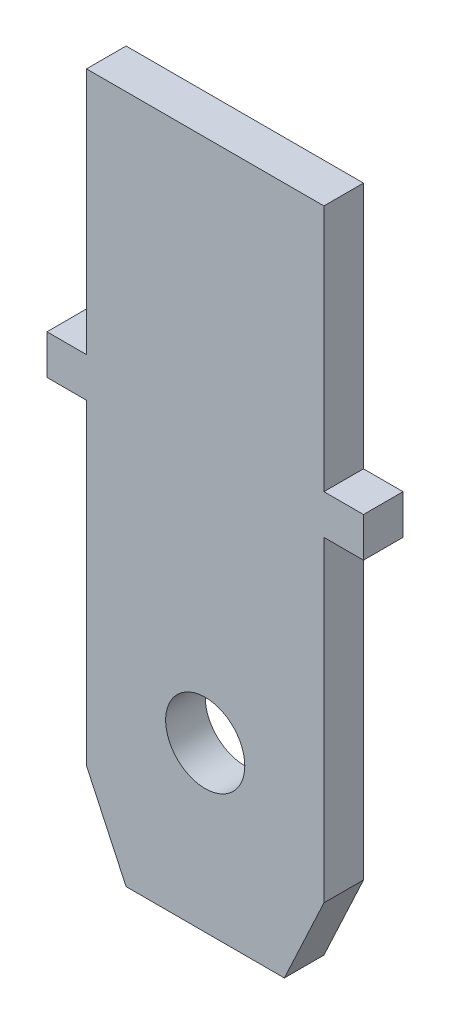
SolidWorks part; units mm, degrees
ref_plane "Plan de face" through (0, 0, 0) normal (0, 0, 1) x (1, 0, 0)
ref_plane "Plan de dessus" through (0, 0, 0) normal (0, 1, 0) x (1, 0, 0)
ref_plane "Plan de droite" through (0, 0, 0) normal (1, 0, 0) x (0, 0, -1)
sketch "Esquisse1" plane through (0, 0, 0) normal (0, 0, 1) x (1, 0, 0)
  line L0 (0, 0) -> (0, 1)
  line L1 (0, 1) -> (1, 1)
  line L2 (1, 1) -> (1, 7.2547)
  line L3 (1, 7.2547) -> (7, 7.2547)
  line L4 (7, 7.2547) -> (7, 1)
  line L5 (7, 1) -> (8, 1)
  line L6 (8, 1) -> (8, 0)
  line L7 (8, 0) -> (7, 0)
  line L8 (7, 0) -> (7, -8)
  line L9 (7, -8) -> (6, -10.1445)
  line L10 (6, -10.1445) -> (2, -10.1445)
  line L11 (2, -10.1445) -> (1, -8)
  line L12 (1, -8) -> (1, 0)
  line L13 (1, 0) -> (0, 0)
  line L14 (4, -14.7929) -> (4, 9.4906) construction
  circle A0 centre (4, -6) radius 1
  dimension "D15" = 2
  dimension "D1" = 6
  dimension "D2" = 1
  dimension "D3" = 3
  dimension "D4" = 3
  dimension "D5" = 1
  dimension "D6" = 1
  dimension "D7" = 6
  dimension "D8" = 17.3992
  dimension "D9" = 1
  dimension "D10" = 2
  dimension "D11" = 2
  dimension "D12" = 25
  dimension "D13" = 25
  dimension "D14" = 8
  dimension "D16" = 6
extrude "Boss.-Extru.1" add sketch "Esquisse1" along normal blind 1
